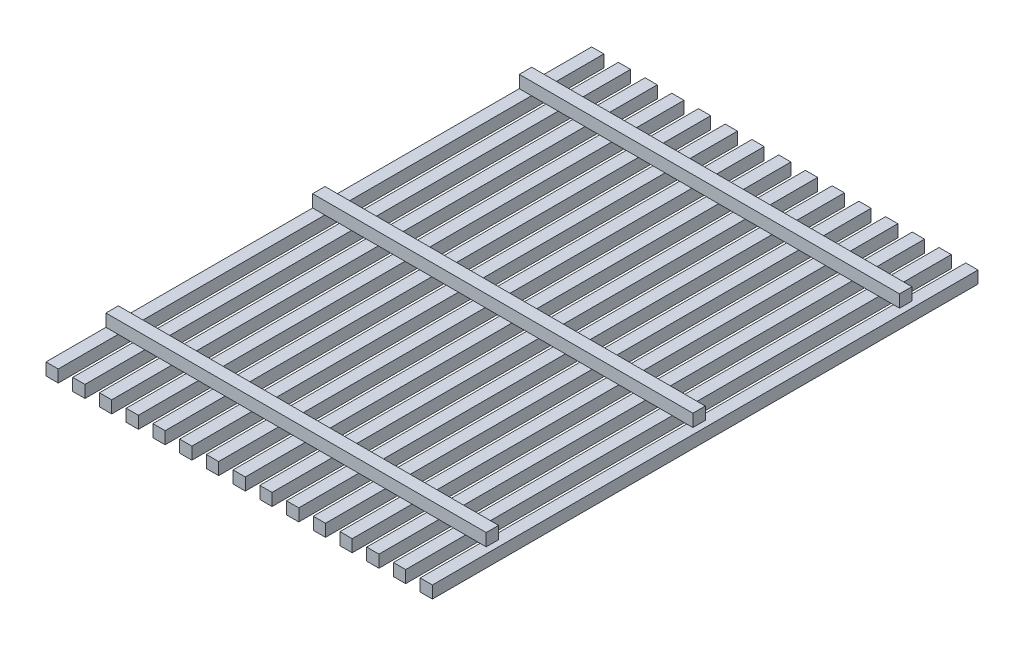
SolidWorks part; units mm, degrees
ref_plane "Front Plane" through (0, 0, 0) normal (0, 0, 1) x (1, 0, 0)
ref_plane "Top Plane" through (0, 0, 0) normal (0, 1, 0) x (1, 0, 0)
ref_plane "Right Plane" through (0, 0, 0) normal (1, 0, 0) x (0, 0, -1)
sketch "Sketch1" plane through (0, 0, 0) normal (0, 1, 0) x (1, 0, 0)
  line L0 (-146.05, 0) -> (146.05, 0)
  line L1 (146.05, -209.55) -> (-146.05, -209.55) construction
  line L2 (146.05, -209.55) -> (146.05, 209.55) construction
  line L3 (146.05, 209.55) -> (-146.05, 209.55) construction
  line L4 (-146.05, -209.55) -> (-146.05, 209.55) construction
  line L5 (146.05, -209.55) -> (-146.05, 209.55) construction
  line L6 (146.05, 209.55) -> (-146.05, -209.55) construction
  line L7 (-146.05, -158.75) -> (146.05, -158.75)
  line L8 (146.05, 0) -> (-146.05, -209.55) construction
  line L9 (-146.05, 158.75) -> (146.05, 158.75)
  point P0 (0, 0)
  dimension "D1" = 419.1
  dimension "D2" = 292.1
  dimension "D3" = 50.8
  dimension "D4" = 50.8
ref_plane "Plane1" through (-146.05, 0, 209.55) normal (0, 0, -1) x (-1, 0, 0)
sketch "Sketch2" plane through (-146.05, 0, 209.55) normal (0, 0, -1) x (-1, 0, 0)
  line L0 (-292.1, 0) -> (0, 0) construction
  line L1 (0, 0) -> (-9.398, 0)
  line L2 (0, 0) -> (0, -9.398)
  line L3 (0, -9.398) -> (-9.398, -9.398)
  line L4 (-9.398, 0) -> (-9.398, -9.398)
  line L5 (-292.1, 0) -> (0, 0) construction
  line L6 (-292.1, 0) -> (0, 0) construction
  dimension "D1" = 9.398
extrude "Extrude1" add sketch "Sketch2" along normal up to vertex
pattern_curve "CrvPattern1" parameters "D1"=15, "D3"=17.78, "D2"=1, "D4"=2.54
ref_plane "Plane2" through (-146.05, 0, -158.75) normal (1, 0, 0) x (0, 0, -1)
sketch "Sketch3" plane through (-146.05, 0, -158.75) normal (1, 0, 0) x (0, 0, -1)
  line L0 (-368.3, 0) -> (50.8, 0) construction
  line L1 (4.7625, 0) -> (-4.7625, 0)
  line L2 (4.7625, 0) -> (4.7625, 9.525)
  line L3 (4.7625, 9.525) -> (-4.7625, 9.525)
  line L4 (-4.7625, 0) -> (-4.7625, 9.525)
  line L7 (-153.9875, 9.525) -> (-163.5125, 9.525)
  line L8 (-153.9875, 9.525) -> (-153.9875, 0)
  line L9 (-153.9875, 0) -> (-163.5125, 0)
  line L10 (-163.5125, 9.525) -> (-163.5125, 0)
  line L11 (-322.2625, 9.525) -> (-312.7375, 9.525)
  line L12 (-322.2625, 9.525) -> (-322.2625, 0)
  line L13 (-322.2625, 0) -> (-312.7375, 0)
  line L14 (-312.7375, 9.525) -> (-312.7375, 0)
  dimension "D1" = 9.525
  dimension "D2" = 9.525
extrude "Extrude2" add sketch "Sketch3" along normal up to vertex
sketch "Sketch4" [suppressed] plane through (0, 0, -209.55) normal (0, 0, -1) x (-1, 0, 0)
  line L4 (146.05, -9.398) -> (146.05, 0)
  line L5 (146.05, 0) -> (136.652, 0)
  line L6 (136.652, 0) -> (136.652, -9.398)
  line L7 (136.652, -9.398) -> (146.05, -9.398)
  line L8 (146.05, -9.398) -> (146.05, 0)
  line L9 (146.05, 0) -> (136.652, 0)
  line L10 (136.652, 0) -> (136.652, -9.398)
  line L11 (136.652, -9.398) -> (146.05, -9.398)
  dimension "D1" = 0
sketch "Sketch5" [suppressed] plane through (0, -9.398, 0) normal (0, -1, 0) x (1, 0, 0)
  line L4 (-136.652, 209.55) -> (-146.05, 209.55)
  line L5 (-146.05, 209.55) -> (-146.05, -209.55)
  line L6 (-146.05, -209.55) -> (-136.652, -209.55)
  line L7 (-136.652, -209.55) -> (-136.652, 209.55)
  line L8 (-136.652, 209.55) -> (-146.05, 209.55)
  line L9 (-146.05, 209.55) -> (-146.05, -209.55)
  line L10 (-146.05, -209.55) -> (-136.652, -209.55)
  line L11 (-136.652, -209.55) -> (-136.652, 209.55)
  dimension "D1" = 0
extrude "Extrude4" [suppressed] cut sketch "Sketch5" against normal through all
